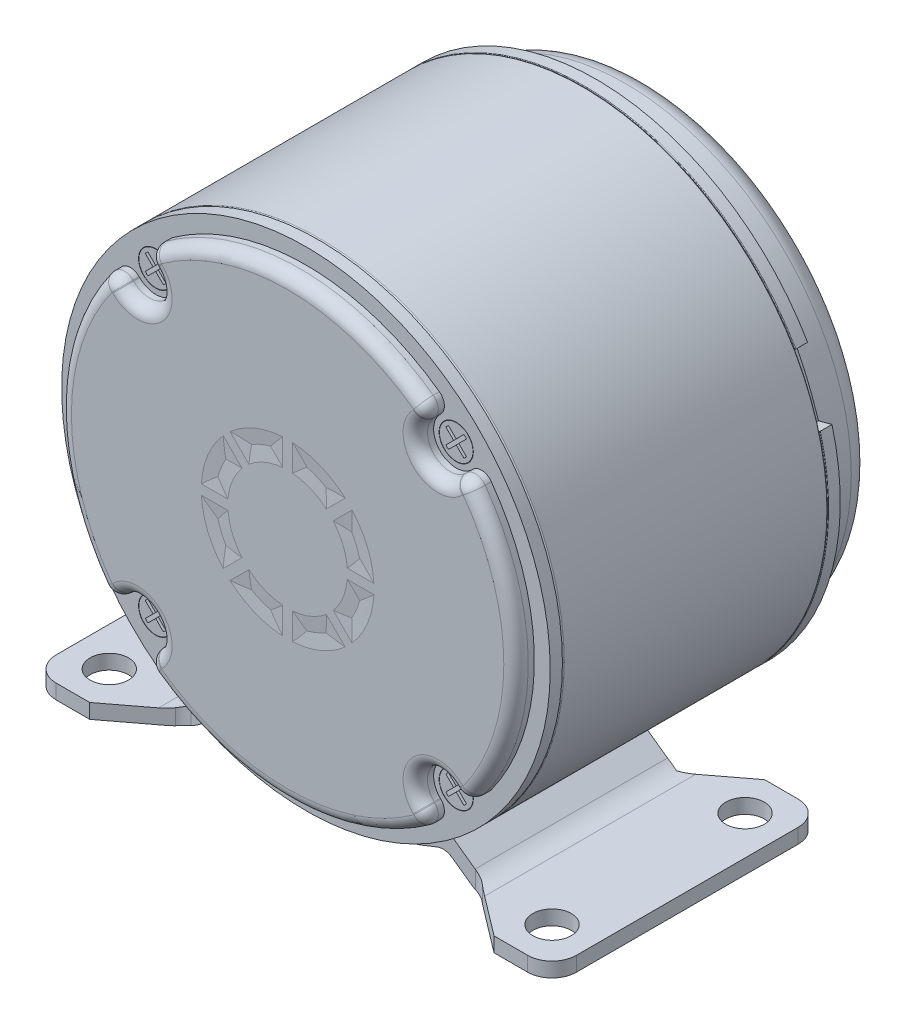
SolidWorks part; units mm, degrees
ref_plane "Front Plane" through (0, 0, 0) normal (0, 0, 1) x (1, 0, 0)
ref_plane "Top Plane" through (0, 0, 0) normal (0, 1, 0) x (1, 0, 0)
ref_plane "Right Plane" through (0, 0, 0) normal (1, 0, 0) x (0, 0, -1)
sketch "Sketch1" plane through (0, 0, 0) normal (0, 0, 1) x (1, 0, 0)
  circle A0 centre (0, 0) radius 50.8
extrude "Boss-Extrude1" add sketch "Sketch1" along normal blind 55.118
ref_plane "Plane1" through (0, 0, 51.943) normal (0, 0, 1) x (1, 0, 0)
sketch "Sketch2" plane through (0, 0, 51.943) normal (0, 0, 1) x (1, 0, 0)
  line L1 (-23.1775, -48.6609) -> (-23.1775, -45.2045)
  line L2 (23.1775, -48.6609) -> (23.1775, -45.2045)
  circle A0 centre (0, 0) radius 50.8 construction
  arc A1 (-23.1775, -48.6609) -> (23.1775, -48.6609) centre (0, 0) ccw
  arc A2 (-23.1775, -45.2045) -> (23.1775, -45.2045) centre (0, 0) ccw
extrude "Boss-Extrude2" add sketch "Sketch2" against normal blind 38.481
sketch "Sketch3" plane through (0, 0, 51.943) normal (0, 0, 1) x (1, 0, 0)
  line L0 (0, -53.8988) -> (0, -57.8271)
  line L2 (30.48, -53.8988) -> (23.1775, -48.6609)
  line L3 (23.1775, -48.6609) -> (24.954, -46.1842)
  line L4 (24.954, -46.1842) -> (31.4601, -50.8508)
  line L5 (24.954, -46.1842) -> (23.4102, -45.0768)
  line L6 (30.48, -53.8988) -> (54.102, -53.8988)
  line L7 (54.102, -53.8988) -> (54.102, -50.8508)
  line L8 (54.102, -50.8508) -> (31.4601, -50.8508)
  line L9 (23.1775, -45.2045) -> (23.4102, -45.0768)
  arc A0 (-23.1775, -48.6609) -> (23.1775, -48.6609) centre (0, 0) ccw construction
  arc A1 (-23.1775, -45.2045) -> (23.1775, -45.2045) centre (0, 0) ccw
extrude "Boss-Extrude3" add sketch "Sketch3" against normal blind 47.625 contours L7 L8 L4 L3 L2 L6 | L9 L3 L5 M2
mirror "Mirror1" about plane through (0, 0, 0) normal (1, 0, 0) of "Boss-Extrude3", "Boss-Extrude2"
sketch "Sketch4" plane through (0, 0, 51.943) normal (0, 0, 1) x (1, 0, 0)
  line L0 (54.102, -50.8508) -> (31.877, -50.8508)
  line L1 (54.102, -50.8508) -> (31.4601, -50.8508) construction
  line L2 (31.877, -50.8508) -> (31.877, -53.8988)
  line L3 (30.48, -53.8988) -> (54.102, -53.8988) construction
  line L4 (31.877, -53.8988) -> (54.102, -53.8988)
  line L5 (54.102, -53.8988) -> (54.102, -50.8508)
  line L7 (31.877, -50.8508) -> (54.102, -50.8508)
  line L8 (31.877, -50.8508) -> (31.877, -53.8988)
  line L9 (31.877, -53.8988) -> (54.102, -53.8988)
  line L10 (54.102, -50.8508) -> (54.102, -53.8988)
extrude "Boss-Extrude4" add sketch "Sketch4" along normal blind 8.636 contours L2 M5 M3 M4
sketch "Sketch5" plane through (0, 0, 4.318) normal (0, 0, -1) x (-1, 0, 0)
  line L0 (-31.4601, -50.8508) -> (-31.4601, -53.8988)
  line L1 (-30.48, -53.8988) -> (-54.102, -53.8988) construction
  line L2 (-31.4601, -53.8988) -> (-30.48, -53.8988)
  line L3 (-30.48, -53.8988) -> (-23.1775, -48.6609)
  line L4 (-23.1775, -48.6609) -> (-23.1775, -45.2045)
  line L6 (-31.4601, -50.8508) -> (-23.4163, -45.0812)
  line L7 (-23.4163, -45.0812) -> (-23.1775, -45.2045)
extrude "Cut-Extrude1" cut sketch "Sketch5" against normal blind 7.62
mirror "Mirror2" about plane through (0, 0, 0) normal (1, 0, 0) of "Cut-Extrude1"
mirror "Mirror3" about plane through (0, 0, 0) normal (1, 0, 0) of "Boss-Extrude4"
sketch "Sketch6" plane through (0, -53.8988, 0) normal (0, -1, 0) x (1, 0, 0)
  line L0 (-54.102, 60.579) -> (-42.037, 60.579)
  line L1 (-31.6333, 52.6774) -> (-30.3703, 52.959)
  line L6 (-31.6333, 52.6774) -> (-42.037, 60.579)
  line L8 (-30.3703, 52.959) -> (-30.3703, 61.2692)
  line L9 (-30.3703, 61.2692) -> (-42.037, 60.579)
  line L10 (-42.037, 60.579) -> (-42.0006, 60.5796)
extrude "Cut-Extrude4" cut sketch "Sketch6" against normal blind 7.62 contours L6 L1 L8 L9
mirror "Mirror4" about plane through (0, 0, 0) normal (1, 0, 0) of "Cut-Extrude4"
ref_plane "Plane2" through (0, 0, 32.4485) normal (0, 0, 1) x (1, 0, 0)
mirror "Mirror6" about plane through (0, 0, 32.4485) normal (0, 0, 1) of "Mirror4", "Cut-Extrude4"
sketch "Sketch10" plane through (0, -53.8988, 0) normal (0, -1, 0) x (1, 0, 0)
  line L0 (54.102, 32.4485) -> (38.4423, 32.4485)
  line L2 (54.102, 4.318) -> (54.102, 60.579) construction
  line L3 (31.4601, 12.181) -> (31.4601, 51.943) construction
  circle A0 centre (46.0375, 52.5145) radius 4
  circle A1 centre (46.0375, 12.3825) radius 4
  dimension "D1" = 8
  dimension "D2" = 14.5774
  dimension "D3" = 40.132
extrude "Cut-Extrude6" cut sketch "Sketch10" against normal blind 6.35 contours A0 | A1
mirror "Mirror7" about plane through (0, 0, 0) normal (1, 0, 0) of "Cut-Extrude6"
fillet "Fillet1" radius 5.08 4 edges at (-54.102, -52.3748, 60.579) (54.102, -52.3748, 4.318) (-54.102, -52.3748, 4.318) (54.102, -52.3748, 60.579)
fillet "Fillet2" radius 7.62 20 edges at (-31.6685, -50.8508, 51.943) (-31.877, -50.8508, 52.4028) (-31.877, -53.8988, 52.4028) (31.877, -53.8988, 52.4028) (31.877, -50.8508, 52.4028) (31.4601, -50.8508, 32.062) (30.48, -53.8988, 31.9527) (30.4252, -53.8595, 11.9502) (30.9152, -50.46, 12.0595) (31.0566, -53.8988, 12.091) (31.5467, -50.8508, 12.2003) (-30.48, -53.8988, 31.9527) (-31.4601, -50.8508, 32.062) (31.1785, -53.8988, 51.943) (-31.0566, -53.8988, 12.091) (-30.4252, -53.8595, 11.9502) (-30.9152, -50.46, 12.0595) (-31.5467, -50.8508, 12.2003) (-31.1785, -53.8988, 51.943) (31.6685, -50.8508, 51.943)
fillet "Fillet3" radius 3.302 2 edges at (-23.1775, -48.6609, 32.7025) (23.1775, -48.6609, 32.7025)
sketch "Sketch12" plane through (0, 0, 51.943) normal (0, 0, 1) x (1, 0, 0)
  line L0 (23.4163, -45.0812) -> (22.873, -45.3634)
  line L1 (23.4163, -45.0812) -> (29.4691, -49.4227) construction
  line L2 (23.9493, -45.4635) -> (23.4163, -45.0812)
  arc A0 (22.873, -45.3634) -> (23.9493, -45.4635) centre (23.325, -46.3402) cw
extrude "Cut-Extrude7" cut sketch "Sketch12" against normal through all both and the other way through all
mirror "Mirror8" about plane through (0, 0, 0) normal (1, 0, 0) of "Cut-Extrude7"
fillet "Fillet4" radius 3.302 4 edges at (-31.877, -52.2001, 51.943) (-23.1775, -46.9675, 13.462) (23.1775, -46.9675, 13.462) (31.877, -52.2001, 51.943)
sketch "Sketch13" plane through (0, 0, 0) normal (0, 0, -1) x (-1, 0, 0)
  circle A0 centre (0, 0) radius 49.53
extrude "Boss-Extrude5" add sketch "Sketch13" along normal blind 0.127 contours A0
sketch "Sketch14" plane through (0, 0, -0.127) normal (0, 0, -1) x (-1, 0, 0)
  line L0 (-47.879, 0) -> (-50.8, 0)
  line L1 (-46.2476, 12.392) -> (-49.069, 13.148)
  line L2 (-41.4644, 23.9395) -> (-43.9941, 25.4)
  arc A0 (-49.069, 13.148) -> (-43.9941, 25.4) centre (0, 0) ccw
  arc A2 (-41.4644, 23.9395) -> (-46.2476, 12.392) centre (16.1911, -6.7066) ccw
extrude "Boss-Extrude7" add sketch "Sketch14" along normal blind 2.54
fillet "Fillet6" radius 0.127 1 edges at (50.8, 0, 0)
fillet "Fillet7" radius 0.127 1 edges at (-46.9331, -19.4403, -0.127)
ref_plane "Plane4" through (0, 0, -2.667) normal (0, 0, -1) x (-1, 0, 0)
sketch "Sketch15" plane through (0, 0, -2.667) normal (0, 0, -1) x (-1, 0, 0)
  circle A1 centre (0, 0) radius 46.99
extrude "Boss-Extrude8" add sketch "Sketch15" along normal blind 10.414
ref_plane "Plane5" through (0, 0, -13.081) normal (0, 0, -1) x (-1, 0, 0)
sketch "Sketch16" plane through (0, 0, -13.081) normal (0, 0, -1) x (-1, 0, 0)
  circle A1 centre (0, 0) radius 15.748
extrude "Boss-Extrude9" add sketch "Sketch16" along normal blind 4.572
fillet "Fillet8" radius 4.318 1 edges at (-46.99, 0, -13.081)
fillet "Fillet9" radius 1.778 1 edges at (-15.748, 0, -17.653)
ref_plane "Plane9" through (0, 0, -15.621) normal (0, 0, -1) x (-1, 0, 0)
sketch "Sketch21" plane through (0, 0, -13.081) normal (0, 0, -1) x (-1, 0, 0)
  line L0 (0, 42.672) -> (0, 40.132)
  line L3 (1.27, 15.6548) -> (1.27, 15.5187)
  line L4 (-0.4318, 40.132) -> (0.4318, 40.132)
  line L5 (0.4318, 40.132) -> (1.27, 15.6548)
  line L8 (-1.27, 15.6548) -> (-1.27, 15.5187)
  line L9 (-0.4318, 40.132) -> (-1.27, 15.6548)
  line L10 (-1.27, 15.0532) -> (1.27, 14.958)
  line L11 (1.27, 14.958) -> (1.27, 15.5187)
  line L12 (-1.27, 15.5187) -> (-1.27, 15.0532)
  circle A0 centre (0, 0) radius 42.672 construction
extrude "Boss-Extrude10" add sketch "Sketch21" along normal blind 2.54 separate body contours L9 L8 L12 L10 L11 L3 L5 L4
ref_plane "Plane10" through (0, 0, 0) normal (1, 0, 0) x (0, 0, -1)
fillet "Fillet14" radius 0.381 1 edges at (50.8, 0, 55.118)
sketch "Sketch26" plane through (0, 0, 55.118) normal (0, 0, 1) x (1, 0, 0)
  circle A0 centre (0, 0) radius 50.8
extrude "Boss-Extrude12" add sketch "Sketch26" along normal blind 2.54
sketch "Sketch27" plane through (0, 0, 57.658) normal (0, 0, 1) x (1, 0, 0)
  line L2 (34.574, -27.9286) -> (34.698, -28.0526)
  line L3 (27.9286, 34.574) -> (28.0526, 34.698)
  line L4 (27.9286, -34.574) -> (28.0526, -34.698)
  line L5 (34.574, 27.9286) -> (34.698, 28.0526)
  line L6 (-27.9286, -34.574) -> (-28.0526, -34.698)
  line L7 (-34.574, -27.9286) -> (-34.698, -28.0526)
  line L8 (-34.574, 27.9286) -> (-34.698, 28.0526)
  line L9 (-27.9286, 34.574) -> (-28.0526, 34.698)
  arc A0 (27.74, 38.5559) -> (-27.74, 38.5559) centre (0, 0) ccw
  arc A1 (27.9286, 34.574) -> (34.574, 27.9286) centre (31.2513, 31.2513) ccw
  arc A2 (34.698, 28.0526) -> (38.5559, 27.74) centre (36.494, 26.2566) cw
  arc A3 (27.74, 38.5559) -> (28.0526, 34.698) centre (26.2566, 36.494) cw
  arc A4 (34.574, -27.9286) -> (27.9286, -34.574) centre (31.2513, -31.2513) ccw
  arc A5 (28.0526, -34.698) -> (27.74, -38.5559) centre (26.2566, -36.494) cw
  arc A6 (38.5559, -27.74) -> (34.698, -28.0526) centre (36.494, -26.2566) cw
  arc A7 (-27.9286, -34.574) -> (-34.574, -27.9286) centre (-31.2513, -31.2513) ccw
  arc A8 (-34.698, -28.0526) -> (-38.5559, -27.74) centre (-36.494, -26.2566) cw
  arc A9 (-27.74, -38.5559) -> (-28.0526, -34.698) centre (-26.2566, -36.494) cw
  arc A10 (-34.574, 27.9286) -> (-27.9286, 34.574) centre (-31.2513, 31.2513) ccw
  arc A11 (-28.0526, 34.698) -> (-27.74, 38.5559) centre (-26.2566, 36.494) cw
  arc A12 (-38.5559, 27.74) -> (-34.698, 28.0526) centre (-36.494, 26.2566) cw
  arc A13 (-38.5559, 27.74) -> (-38.5559, -27.74) centre (0, 0) ccw
  arc A14 (-27.74, -38.5559) -> (27.74, -38.5559) centre (0, 0) ccw
  arc A15 (38.5559, -27.74) -> (38.5559, 27.74) centre (0, 0) ccw
  dimension "D1" = 2.54
  dimension "D2" = 4
extrude "Boss-Extrude13" add sketch "Sketch27" along normal blind 3.81
pattern_circular "CirPattern2" count 16 over 360 about axis through (0, 0, 0) along (0, 0, 1) of "Boss-Extrude10"
sketch "Sketch28" plane through (0, 0, 57.658) normal (0, 0, 1) x (1, 0, 0)
  line L0 (31.2513, 30.7125) -> (32.8677, 29.096)
  line L1 (31.7901, 31.2513) -> (33.4066, 32.8677)
  line L2 (31.2513, 31.7901) -> (29.6348, 33.4066)
  line L3 (30.7125, 31.2513) -> (29.096, 29.6348)
  line L4 (-30.7125, 31.2513) -> (-29.096, 32.8677)
  line L5 (-31.2513, 31.7901) -> (-32.8677, 33.4066)
  line L6 (-31.7901, 31.2513) -> (-33.4066, 29.6348)
  line L7 (-31.2513, 30.7125) -> (-29.6348, 29.096)
  line L8 (-31.2513, 31.7901) -> (-29.6348, 33.4066)
  line L9 (-31.7901, 31.2513) -> (-33.4066, 32.8677)
  line L10 (-30.7125, 31.2513) -> (-29.096, 29.6348)
  line L11 (-31.2513, 30.7125) -> (-32.8677, 29.096)
  line L12 (-32.8677, 33.4066) -> (-33.4066, 32.8677)
  line L13 (-29.6348, 33.4066) -> (-29.096, 32.8677)
  line L14 (-29.096, 29.6348) -> (-29.6348, 29.096)
  line L15 (-32.8677, 29.096) -> (-33.4066, 29.6348)
  line L16 (31.7901, 31.2513) -> (33.4066, 29.6348)
  line L17 (31.2513, 31.7901) -> (32.8677, 33.4066)
  line L18 (31.2513, 30.7125) -> (29.6348, 29.096)
  line L19 (30.7125, 31.2513) -> (29.096, 32.8677)
  line L20 (33.4066, 32.8677) -> (32.8677, 33.4066)
  line L21 (33.4066, 29.6348) -> (32.8677, 29.096)
  line L22 (29.6348, 29.096) -> (29.096, 29.6348)
  line L23 (29.096, 32.8677) -> (29.6348, 33.4066)
  line L24 (30.7125, -31.2513) -> (29.096, -32.8677)
  line L25 (31.2513, -31.7901) -> (32.8677, -33.4066)
  line L26 (31.7901, -31.2513) -> (33.4066, -29.6348)
  line L27 (31.2513, -30.7125) -> (29.6348, -29.096)
  line L28 (31.2513, -31.7901) -> (29.6348, -33.4066)
  line L29 (31.7901, -31.2513) -> (33.4066, -32.8677)
  line L30 (30.7125, -31.2513) -> (29.096, -29.6348)
  line L31 (31.2513, -30.7125) -> (32.8677, -29.096)
  line L32 (32.8677, -33.4066) -> (33.4066, -32.8677)
  line L33 (29.6348, -33.4066) -> (29.096, -32.8677)
  line L34 (29.096, -29.6348) -> (29.6348, -29.096)
  line L35 (32.8677, -29.096) -> (33.4066, -29.6348)
  line L36 (-31.2513, -30.7125) -> (-32.8677, -29.096)
  line L37 (-31.7901, -31.2513) -> (-33.4066, -32.8677)
  line L38 (-31.2513, -31.7901) -> (-29.6348, -33.4066)
  line L39 (-30.7125, -31.2513) -> (-29.096, -29.6348)
  line L40 (-31.7901, -31.2513) -> (-33.4066, -29.6348)
  line L41 (-31.2513, -31.7901) -> (-32.8677, -33.4066)
  line L42 (-31.2513, -30.7125) -> (-29.6348, -29.096)
  line L43 (-30.7125, -31.2513) -> (-29.096, -32.8677)
  line L44 (-33.4066, -32.8677) -> (-32.8677, -33.4066)
  line L45 (-33.4066, -29.6348) -> (-32.8677, -29.096)
  line L46 (-29.6348, -29.096) -> (-29.096, -29.6348)
  line L47 (-29.096, -32.8677) -> (-29.6348, -33.4066)
  circle A0 centre (-31.2513, 31.2513) radius 3.4925
  circle A1 centre (-31.2513, 31.2513) radius 3.556
  circle A2 centre (31.2513, 31.2513) radius 3.4925
  circle A3 centre (31.2513, 31.2513) radius 3.556
  circle A4 centre (31.2513, -31.2513) radius 3.4925
  circle A5 centre (31.2513, -31.2513) radius 3.556
  circle A6 centre (-31.2513, -31.2513) radius 3.4925
  circle A7 centre (-31.2513, -31.2513) radius 3.556
  point P68 (0, 0)
  dimension "D1" = 4
  dimension "D3" = 0.0635
extrude "Cut-Extrude10" cut sketch "Sketch28" against normal blind 3.81 contours A1 A0 | L47 L43 L39 L46 L42 L36 L45 L40 L37 L44 L41 L38 | A7 A6 | L35 L31 L27 L34 L30 L24 L33 L28 L25 L32 L29 L26 | A5 A4 | L23 L19 L3 L22 L18 L0 L21 L16 L1 L20 L17 L2 | A3 A2 | L9 L12 L5 L8 L13 L4 L10 L14 L7 L11 L15 L6
fillet "Fillet15" radius 2.54 24 edges at (47.498, 0, 61.468) (36.6992, -28.7883, 61.468) (34.636, -27.9906, 61.468) (27.9286, -27.9286, 61.468) (27.9906, -34.636, 61.468) (28.7883, -36.6992, 61.468) (0, -47.498, 61.468) (-28.7883, -36.6992, 61.468) (-27.9906, -34.636, 61.468) (-27.9286, -27.9286, 61.468) (-34.636, -27.9906, 61.468) (-36.6992, -28.7883, 61.468) (-47.498, 0, 61.468) (-36.6992, 28.7883, 61.468) (-34.636, 27.9906, 61.468) (-27.9286, 27.9286, 61.468) (-27.9906, 34.636, 61.468) (-28.7883, 36.6992, 61.468) (0, 47.498, 61.468) (28.7883, 36.6992, 61.468) (27.9906, 34.636, 61.468) (27.9286, 27.9286, 61.468) (34.636, 27.9906, 61.468) (36.6992, 28.7883, 61.468)
sketch "Sketch36" plane through (0, 0, 61.468) normal (0, 0, 1) x (1, 0, 0)
  line L0 (1.016, 12.4045) -> (1.016, 17.9418)
  line L1 (1.016, -17.9418) -> (1.016, -12.4045)
  line L2 (-1.016, -17.9418) -> (-1.016, -12.4045)
  line L3 (-1.016, 12.4045) -> (-1.016, 17.9418)
  line L4 (-11.9683, -13.4052) -> (-8.0529, -9.4897)
  line L5 (-13.4052, -11.9683) -> (-9.4897, -8.0529)
  line L6 (9.4897, 8.0529) -> (13.4052, 11.9683)
  line L7 (8.0529, 9.4897) -> (11.9683, 13.4052)
  line L8 (-17.9418, -1.016) -> (-12.4045, -1.016)
  line L9 (-17.9418, 1.016) -> (-12.4045, 1.016)
  line L10 (12.4045, -1.016) -> (17.9418, -1.016)
  line L11 (12.4045, 1.016) -> (17.9418, 1.016)
  line L12 (-13.4052, 11.9683) -> (-9.4897, 8.0529)
  line L13 (-11.9683, 13.4052) -> (-8.0529, 9.4897)
  line L14 (8.0529, -9.4897) -> (11.9683, -13.4052)
  line L15 (9.4897, -8.0529) -> (13.4052, -11.9683)
  line L16 (-1.016, 17.9418) -> (-1.016, 12.4045)
  line L17 (1.016, 17.9418) -> (1.016, 12.4045)
  line L18 (-1.016, -12.4045) -> (-1.016, -17.9418)
  line L19 (1.016, -12.4045) -> (1.016, -17.9418)
  line L20 (11.9683, 13.4052) -> (8.0529, 9.4897)
  line L21 (13.4052, 11.9683) -> (9.4897, 8.0529)
  line L22 (-9.4897, -8.0529) -> (-13.4052, -11.9683)
  line L23 (-8.0529, -9.4897) -> (-11.9683, -13.4052)
  line L24 (17.9418, 1.016) -> (12.4045, 1.016)
  line L25 (17.9418, -1.016) -> (12.4045, -1.016)
  line L26 (-12.4045, 1.016) -> (-17.9418, 1.016)
  line L27 (-12.4045, -1.016) -> (-17.9418, -1.016)
  line L28 (13.4052, -11.9683) -> (9.4897, -8.0529)
  line L29 (11.9683, -13.4052) -> (8.0529, -9.4897)
  line L30 (-8.0529, 9.4897) -> (-11.9683, 13.4052)
  line L31 (-9.4897, 8.0529) -> (-13.4052, 11.9683)
  arc A0 (8.0529, 9.4897) -> (1.016, 12.4045) centre (0, 0) ccw
  arc A1 (11.9683, 13.4052) -> (1.016, 17.9418) centre (0, 0) ccw
  arc A2 (-1.016, 12.4045) -> (-8.0529, 9.4897) centre (0, 0) ccw
  arc A3 (-1.016, 17.9418) -> (-11.9683, 13.4052) centre (0, 0) ccw
  arc A4 (-9.4897, 8.0529) -> (-12.4045, 1.016) centre (0, 0) ccw
  arc A5 (-13.4052, 11.9683) -> (-17.9418, 1.016) centre (0, 0) ccw
  arc A6 (17.9418, 1.016) -> (13.4052, 11.9683) centre (0, 0) ccw
  arc A7 (12.4045, 1.016) -> (9.4897, 8.0529) centre (0, 0) ccw
  arc A8 (13.4052, -11.9683) -> (17.9418, -1.016) centre (0, 0) ccw
  arc A9 (9.4897, -8.0529) -> (12.4045, -1.016) centre (0, 0) ccw
  arc A10 (1.016, -12.4045) -> (8.0529, -9.4897) centre (0, 0) ccw
  arc A11 (1.016, -17.9418) -> (11.9683, -13.4052) centre (0, 0) ccw
  arc A12 (-8.0529, -9.4897) -> (-1.016, -12.4045) centre (0, 0) ccw
  arc A13 (-11.9683, -13.4052) -> (-1.016, -17.9418) centre (0, 0) ccw
  arc A14 (-12.4045, -1.016) -> (-9.4897, -8.0529) centre (0, 0) ccw
  arc A15 (-17.9418, -1.016) -> (-13.4052, -11.9683) centre (0, 0) ccw
  point P71 (0, 0)
extrude "Cut-Extrude12" cut sketch "Sketch36" against normal blind 2.54 draft 85 contours L12 A5 L9 A4 | L3 A3 L13 A2 | L7 A1 L0 A0 | A7 L11 A6 L6 | A9 L15 A8 L10 | L1 A11 L14 A10 | L4 A13 L2 A12 | L8 A15 L5 A14
